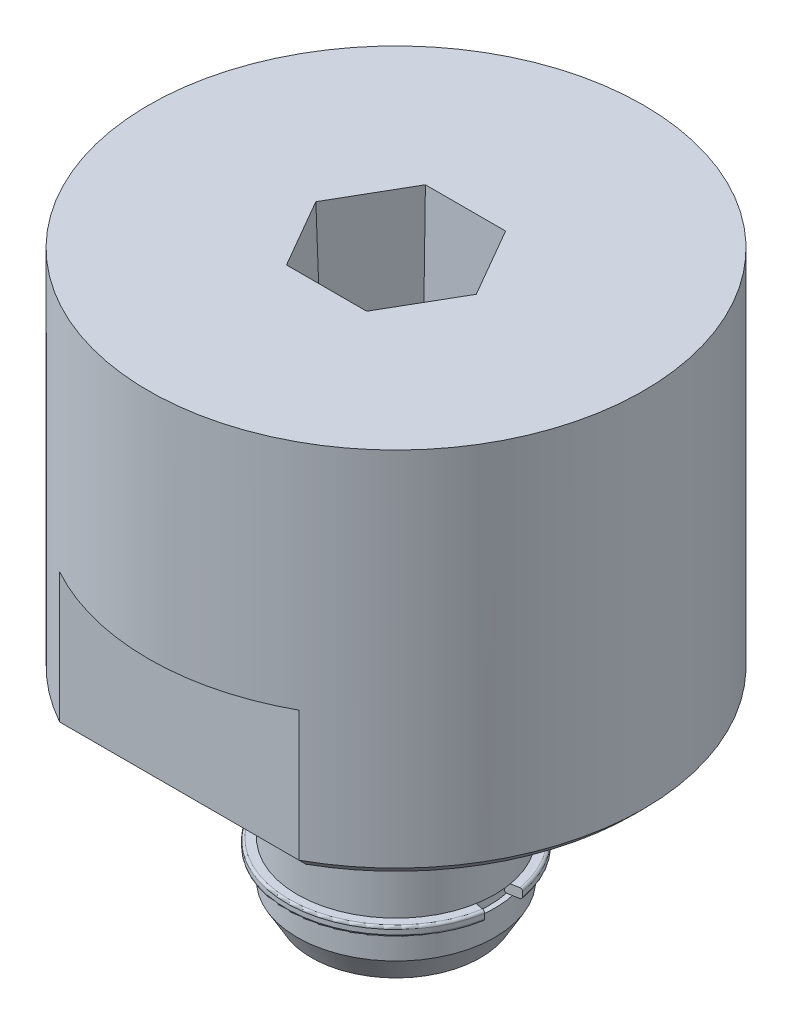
SolidWorks part; units mm, degrees
ref_plane "Front Plane" through (0, 0, 0) normal (0, 0, 1) x (1, 0, 0)
ref_plane "Top Plane" through (0, 0, 0) normal (0, 1, 0) x (1, 0, 0)
ref_plane "Right Plane" through (0, 0, 0) normal (1, 0, 0) x (0, 0, -1)
sketch "Sketch1" plane through (0, 0, 0) normal (0, 0, 1) x (1, 0, 0)
  line L0 (0, 0) -> (0, 17.4951) construction
  line L1 (0, 0) -> (2.7281, 0)
  line L2 (2.7281, 0) -> (3.19, 0.8)
  line L3 (3.19, 0.8) -> (3.19, 1.619)
  line L4 (3.19, 1.619) -> (3.0226, 1.619)
  line L5 (3.0226, 1.619) -> (3.0226, 2)
  line L6 (3.0226, 2) -> (3.19, 2)
  line L7 (3.19, 2) -> (3.19, 6)
  line L8 (3.69, 6.5) -> (7.9975, 6.5)
  line L9 (7.9975, 6.5) -> (7.9975, 18.5)
  line L10 (7.9975, 18.5) -> (0, 18.5)
  line L11 (0, 18.5) -> (0, 0)
  arc A0 (3.19, 6) -> (3.69, 6.5) centre (3.69, 6) cw
  dimension "D10" = 0.5
  dimension "D1" = 15.995
  dimension "D2" = 12
  dimension "D3" = 6.5
  dimension "D4" = 6.38
  dimension "D5" = 30
  dimension "D6" = 0.8
  dimension "D7" = 6.0452
  dimension "D8" = 0.381
  dimension "D9" = 4.5
revolve "Revolve1" add sketch "Sketch1" angle 360 about L0
sketch "Sketch2" plane through (0, 6.5, 0) normal (0, -1, 0) x (1, 0, 0)
  line L0 (-7.9975, 0) -> (7.9975, 0) construction
  line L1 (-3.8678, -7) -> (3.8678, -7)
  line L2 (-3.8678, 7) -> (3.8678, 7)
  arc A0 (-3.8678, -7) -> (3.8678, -7) centre (0, 0) ccw
  circle A1 centre (0, 0) radius 7.9975 construction
  arc A2 (3.8678, 7) -> (-3.8678, 7) centre (0, 0) ccw
  dimension "D1" = 14
extrude "Cut-Extrude1" cut sketch "Sketch2" against normal blind 4.5
sketch "Sketch3" plane through (0, 18.5, 0) normal (0, 1, 0) x (1, 0, 0)
  line L1 (-1.1547, 2) -> (-2.3094, 0)
  line L2 (-2.3094, 0) -> (-1.1547, -2)
  line L3 (-1.1547, -2) -> (1.1547, -2)
  line L4 (1.1547, -2) -> (2.3094, 0)
  line L5 (2.3094, 0) -> (1.1547, 2)
  line L6 (1.1547, 2) -> (-1.1547, 2)
  line L7 (-8.7973, 0) -> (8.7973, 0) construction
  circle A0 centre (0, 0) radius 2 construction
  dimension "D1" = 4
extrude "Cut-Extrude2" cut sketch "Sketch3" against normal blind 7
sketch "Sketch4" plane through (0, 0, 0) normal (0, 0, 1) x (1, 0, 0)
  line L0 (5.75, 6.0694) -> (5.75, 7.1421) construction
  line L2 (5.75, 6.5) -> (6.309, 6.5)
  line L4 (3.8678, 6.5) -> (7.9975, 6.5) construction
  line L5 (5.75, 6.75) -> (5.75, 6.5)
  arc A0 (6.309, 6.5) -> (5.75, 6.75) centre (5.75, 6) ccw
  dimension "D2" = 0.75
  dimension "D3" = 0.25
  dimension "D1" = 5.75
revolve "Cut-Revolve1" cut sketch "Sketch4" angle 360 about L0
pattern_circular "CirPattern1" count 8 over 360 about axis through (0, 0, 0) along (0, 1, 0) of "Cut-Revolve1"
chamfer "Chamfer1" distance 0.3 angle 45 4 edges at (0, 6.5, -7) (7.9975, 6.5, 0) (-7.9975, 6.5, 0) (0, 6.5, 7)
draft "Draft2" type of draft neutral plane draft angle 2 faces to draft 6 parameters "D1"=2
sketch "Sketch5" plane through (0, 11.5, 0) normal (0, 1, 0) x (1, 0, 0)
  circle A0 centre (0, 0) radius 1.5
  dimension "D1" = 3
extrude "Cut-Extrude3" cut sketch "Sketch5" against normal through all
chamfer "Chamfer2" distance 0.75 1 edges at (0, 0, 1.5)
imported_body "VS-25.sldprt"
move or copy body "Body-Move/Copy2" bodies to move or copy 108 placed by mates yes parameters "D1"=0, "D2"=0, "D3"=0
